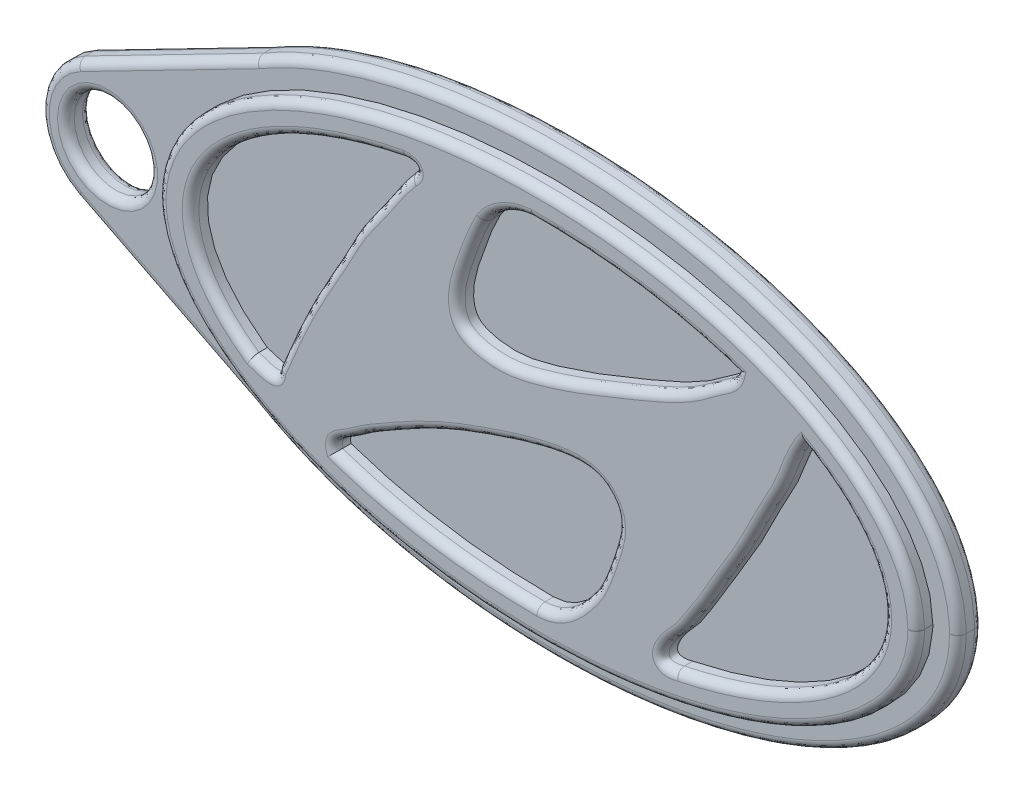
SolidWorks part; units mm, degrees
ref_plane "Front Plane" through (0, 0, 0) normal (0, 0, 1) x (1, 0, 0)
ref_plane "Top Plane" through (0, 0, 0) normal (0, 1, 0) x (1, 0, 0)
ref_plane "Right Plane" through (0, 0, 0) normal (1, 0, 0) x (0, 0, -1)
sketch "Sketch1" plane through (0, 0, 0) normal (0, 0, 1) x (1, 0, 0)
  line L0 (45.449, -0.1365) -> (45.449, -0.0797)
  line L1 (-45.4364, 0.0768) -> (45.449, -0.1365) construction
  line L2 (0.0613, 23.415) -> (-0.0487, -23.4747) construction
  ellipse E0 centre (0.0063, -0.0298) end of major axis (45.449, -0.1365) minor radius 23.4449 (45.449, -0.0797) -> (45.449, -0.1365) ccw
  ellipse E1 centre (0.0063, -0.0298) end of major axis (41.516, -0.0546) minor radius 19.9445 (-15.8921, 18.4011) -> (-34.298, -11.244) ccw
  ellipse E2 centre (0.0063, -0.0298) end of major axis (41.516, -0.0546) minor radius 19.9445 (23.8748, 16.2767) -> (-0.6262, 19.9126) ccw
  ellipse E3 centre (0.0063, -0.0298) end of major axis (41.516, -0.0546) minor radius 19.9445 (16.6844, -18.3013) -> (31.9904, 12.6684) ccw
  ellipse E4 centre (0.0063, -0.0298) end of major axis (41.516, -0.0546) minor radius 19.9445 (-24.274, -16.1953) -> (-0.0056, -19.9743) ccw
  spline S0 degree 2 poles (-15.8921, 18.4011) (-13.7752, 18.516) (-15.1771, 17.1436) knots 0 0 0 1 1 1
  spline S1 degree 3 poles (-31.0969, -10.7536) (-31.0821, -12.7649) (-33.3718, -11.421) (-34.298, -11.244) knots 0 0 0 0 1 1 1 1
  spline S2 degree 3 poles (-31.0969, -10.7536) (-30.2103, -8.6215) (-28.7217, -5.0112) (-26.1392, 0.051) (-23.6604, 4.1881) (-21.6828, 8.2837) (-18.5564, 12.2924) (-16.7174, 15.4048) (-15.1771, 17.1436) knots 0 0 0 0 0.21499 0.363266 0.528425 0.664056 0.784906 1 1 1 1
  spline S3 degree 3 poles (16.6844, -18.3013) (14.2193, -18.9874) (15.2197, -16.168) (17.3833, -14.3272) (18.7127, -12.0527) (20.2565, -9.8776) (21.6594, -7.2465) (23.5575, -4.1655) (25.5479, -0.7797) (27.2927, 3.0771) (29.8973, 7.3769) (30.7821, 10.8663) (31.9904, 12.6684) knots 0 0 0 0 0.092854 0.178807 0.243475 0.301534 0.395592 0.484015 0.594744 0.71314 0.826491 1 1 1 1
  spline S4 degree 3 poles (-24.274, -16.1953) (-24.6019, -15.0497) (-22.6534, -14.1398) (-20.6194, -12.5496) (-18.059, -11.08) (-14.9904, -9.3325) (-11.3661, -7.4957) (-7.7144, -6.0557) (-4.3682, -4.9091) (-1.444, -3.9493) (1.5817, -3.181) (4.5663, -2.6385) (7.7652, -2.9037) (10.1009, -5.69) (9.1953, -9.242) (8.1815, -12.1736) (7.1485, -14.6746) (4.8539, -17.728) (2.5579, -19.9016) (-0.0056, -19.9743) knots 0 0 0 0 0.051396 0.093094 0.141066 0.203782 0.278751 0.353239 0.409108 0.463895 0.514354 0.572143 0.623519 0.674141 0.739053 0.800389 0.84045 0.879125 1 1 1 1
  spline S5 degree 3 poles (-0.6262, 19.9126) (-2.8976, 19.7175) (-5.1181, 18.5444) (-6.3489, 16.5422) knots 0 0 0 0 1 1 1 1
  spline S6 degree 3 poles (-6.3489, 16.5422) (-6.9692, 15.4827) (-8.0428, 12.7403) (-9.1261, 9.6765) (-9.7695, 6.9776) (-9.3043, 4.2696) (-6.5385, 3.3077) (-3.4614, 3.175) (0.4745, 4.1893) (4.3871, 5.45) (9.5681, 7.5774) (14.3475, 9.4145) (18.8298, 11.7639) (21.4624, 13.9318) (23.577, 15.1275) (23.8748, 16.2767) knots 0.100166 0.100166 0.100166 0.100166 0.176797 0.236777 0.286355 0.330322 0.370362 0.433024 0.50169 0.591406 0.660192 0.809872 0.874144 0.936714 1 1 1 1
  point P65 (0, 0)
  point P92 (16.6257, -18.2776)
  point P93 (-7.371, -5.96)
  point P94 (-11.3315, -7.5533)
  point P95 (-20.6637, -12.6519)
  point P96 (0, 0)
  point P97 (18.7804, -12.0102)
  point P98 (-6.3489, 16.5422)
sketch "Sketch2" plane through (0, 0, 0) normal (0, 0, 1) x (1, 0, 0)
  line L1 (-57.1045, 7.1158) -> (-35.7228, 18.1011)
  line L4 (-57.0647, -7.1361) -> (-35.7035, -17.9602)
  circle A0 centre (-53.4487, 0) radius 5
  arc A1 (-57.1045, 7.1158) -> (-57.0647, -7.1361) centre (-53.4487, 0) ccw
  circle A2 centre (-53.4487, 0) radius 8 construction
  spline S1 degree 3 poles (48.449, -0.0596) (48.4456, 1.2148) (48.282, 2.4645) (47.814, 4.3046) (47.6197, 4.9137) (47.169, 6.0947) (46.9119, 6.6699) (46.3399, 7.7926) (46.0249, 8.34) (45.3414, 9.4089) (44.9745, 9.9274) (43.8204, 11.4226) (42.975, 12.3476) (41.6161, 13.6492) (41.1479, 14.0686) (40.1835, 14.8811) (39.686, 15.2751) (38.1707, 16.4089) (37.1274, 17.1041) (33.9176, 19.0428) (31.672, 20.1416) (28.1855, 21.573) (27.0015, 22.0136) (24.6264, 22.819) (23.4316, 23.1853) (19.8284, 24.1869) (17.4009, 24.7259) (12.5027, 25.583) (10.0318, 25.9008) (6.295, 26.222) (5.0431, 26.303) (2.5343, 26.413) (1.2825, 26.4418) (-2.4652, 26.4512) (-4.9536, 26.3552) (-9.9098, 25.9565) (-12.3777, 25.6538) (-16.0628, 25.0301) (-17.2884, 24.7938) (-19.7334, 24.2598) (-20.955, 23.9615) (-24.5945, 22.9688) (-26.9739, 22.1821) (-30.4566, 20.7709) (-31.603, 20.2616) (-33.297, 19.4298) (-33.8581, 19.1407) (-34.8531, 18.6015) (-35.2906, 18.3549) (-35.7228, 18.1011) knots 0 0 0 0 0.015625 0.015625 0.023437 0.023437 0.03125 0.03125 0.039062 0.039062 0.046875 0.046875 0.0625 0.0625 0.070312 0.070312 0.078125 0.078125 0.09375 0.09375 0.125 0.125 0.140625 0.140625 0.15625 0.15625 0.1875 0.1875 0.21875 0.21875 0.234375 0.234375 0.25 0.25 0.28125 0.28125 0.3125 0.3125 0.328125 0.328125 0.34375 0.34375 0.375 0.375 0.390625 0.390625 0.398437 0.398437 0.4047 0.4047 0.4047 0.4047
  spline S3 degree 3 poles (-35.7035, -17.9602) (-33.6906, -19.1482) (-31.5891, -20.1673) (-28.8403, -21.2982) (-28.2545, -21.5279) (-27.0738, -21.9695) (-26.4785, -22.1816) (-24.6902, -22.7889) (-23.4914, -23.1567) (-19.8774, -24.1618) (-17.4447, -24.7014) (-12.5394, -25.5586) (-10.0668, -25.8756) (-6.33, -26.1954) (-5.0797, -26.276) (-2.5699, -26.3851) (-1.3104, -26.4136) (2.4508, -26.421) (4.9457, -26.3231) (9.9104, -25.9201) (12.3801, -25.6151) (17.2921, -24.7799) (19.7344, -24.2502) (23.3735, -23.2553) (24.5833, -22.8895) (26.9701, -22.09) (28.1499, -21.6557) (30.479, -20.7092) (31.6283, -20.1971) (33.3256, -19.3611) (33.887, -19.0709) (34.9931, -18.4697) (35.5387, -18.1582) (37.1511, -17.1886) (38.1939, -16.4956) (40.202, -14.9976) (41.1676, -14.1928) (43.0003, -12.4408) (43.8492, -11.5107) (44.9996, -10.0179) (45.3625, -9.504) (46.0421, -8.4393) (46.3598, -7.8858) (47.2153, -6.1997) (47.6627, -5.0339) (48.1252, -3.2145) (48.2445, -2.5961) (48.4065, -1.3335) (48.448, -0.6972) (48.449, -0.0596) knots 0.595839 0.595839 0.595839 0.595839 0.625 0.625 0.632812 0.632812 0.640625 0.640625 0.65625 0.65625 0.6875 0.6875 0.71875 0.71875 0.734375 0.734375 0.75 0.75 0.78125 0.78125 0.8125 0.8125 0.84375 0.84375 0.859375 0.859375 0.875 0.875 0.890625 0.890625 0.898437 0.898437 0.90625 0.90625 0.921875 0.921875 0.9375 0.9375 0.953125 0.953125 0.960937 0.960937 0.96875 0.96875 0.984375 0.984375 0.992188 0.992188 1 1 1 1
  point P10 (0, 0)
  point P13 (48.4487, 0)
  dimension "D2" = 3
extrude "Boss-Extrude1" add sketch "Sketch1" along normal blind 2
extrude "Boss-Extrude2" add sketch "Sketch2" against normal blind 3
fillet "Fillet1" radius 1 12 edges at (-61.4486, -0.0224, 0) (-61.4486, -0.0224, -3) (-48.4487, 0, -3) (-48.4487, 0, 0)
fillet "Fillet2" radius 1 13 edges at (-12.757, -19.0022, 2) (40.3934, -4.6553, 2) (12.2213, 19.0259, 2) (-39.7721, 5.6884, 2) (45.449, -0.1081, 2) (-45.4364, 0.0484, 2)
